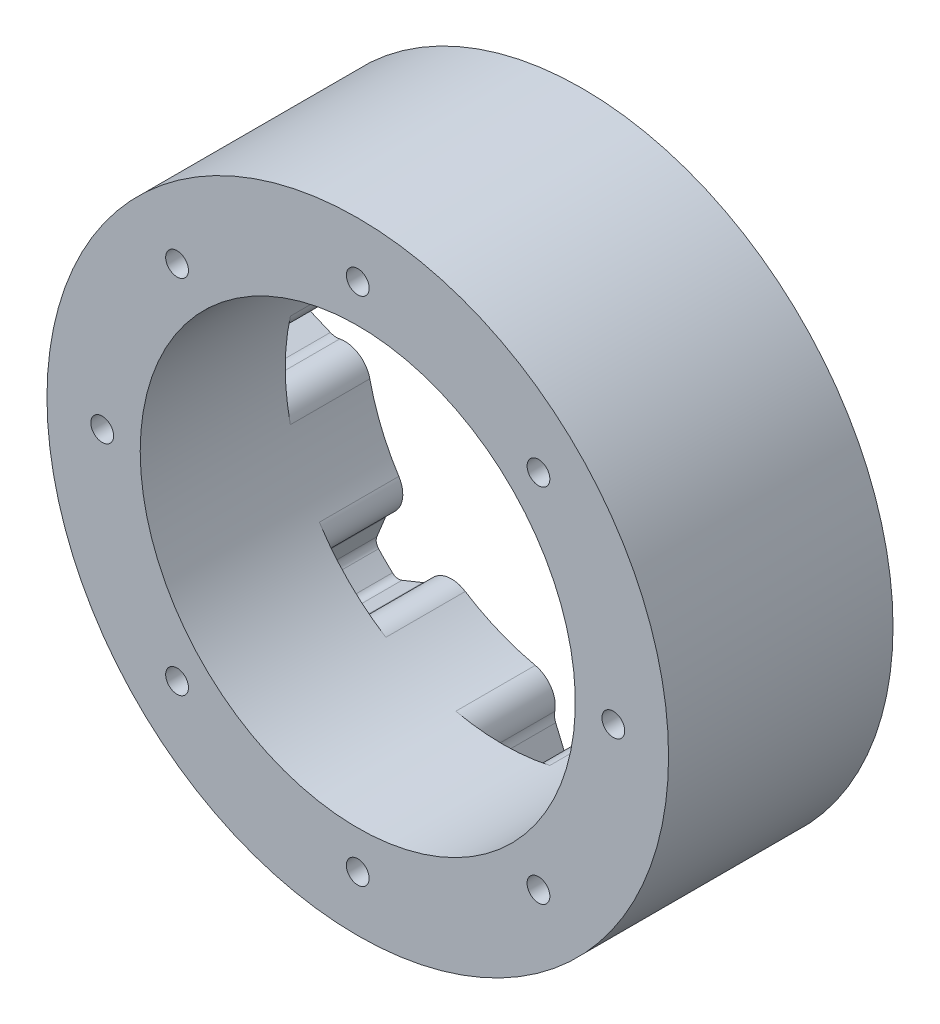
SolidWorks part; units mm, degrees
ref_plane "Front Plane" through (0, 0, 0) normal (1, 0, 0) x (0, 1, 0)
ref_plane "Top Plane" through (0, 0, 0) normal (0, 0, 1) x (0, 1, 0)
ref_plane "Right Plane" through (0, 0, 0) normal (0, 1, 0) x (-1, 0, 0)
sketch "Sketch1" plane through (0, 0, 0) normal (0, 0, 1) x (0, 1, 0)
  circle A0 centre (0, 0) radius 45
  dimension "D1" = 90
extrude "Boss-Extrude1" add sketch "Sketch1" along normal mid plane 32.5
sketch "Sketch2" plane through (0, 0, -16.25) normal (0, 0, -1) x (1, 0, 0)
  line L0 (0, 0) -> (0, 40) construction
  line L1 (-2.2959, 39.365) -> (-3.5687, 36.3529) construction
  line L2 (2.2959, 39.365) -> (3.5687, 36.3529) construction
  line L3 (2.5722, 39.4818) -> (3.8451, 36.4697)
  line L4 (-2.5722, 39.4818) -> (-3.8451, 36.4697)
  circle A0 centre (0, 0) radius 40 construction
  circle A1 centre (0, 0) radius 31.2 construction
  arc A2 (1.41, 39.9751) -> (-1.41, 39.9751) centre (0, 0) ccw construction
  arc A3 (-1.41, 39.9751) -> (-2.2959, 39.365) centre (-1.3747, 38.9758) ccw construction
  arc A4 (-3.5687, 36.3529) -> (-3.6857, 35.1726) centre (-1.7265, 35.5744) ccw construction
  arc A5 (-3.6857, 35.1726) -> (-6.74, 30.4633) centre (-7.6041, 34.3688) cw construction
  arc A6 (3.6857, 35.1726) -> (6.74, 30.4633) centre (7.6041, 34.3688) ccw construction
  arc A7 (3.5687, 36.3529) -> (3.6857, 35.1726) centre (1.7265, 35.5744) cw construction
  arc A8 (1.41, 39.9751) -> (2.2959, 39.365) centre (1.3747, 38.9758) cw construction
  circle A9 centre (0, 0) radius 31.5 construction
  arc A10 (3.9796, 35.1123) -> (6.8048, 30.7562) centre (7.6041, 34.3688) ccw
  arc A11 (3.8451, 36.4697) -> (3.9796, 35.1123) centre (1.7265, 35.5744) cw
  arc A12 (1.4206, 40.275) -> (2.5722, 39.4818) centre (1.3747, 38.9758) cw
  arc A13 (1.4206, 40.275) -> (-1.4206, 40.275) centre (0, 0) ccw
  arc A14 (-1.4206, 40.275) -> (-2.5722, 39.4818) centre (-1.3747, 38.9758) ccw
  arc A15 (-3.8451, 36.4697) -> (-3.9796, 35.1123) centre (-1.7265, 35.5744) ccw
  arc A16 (-3.9796, 35.1123) -> (-6.8048, 30.7562) centre (-7.6041, 34.3688) cw
  arc A17 (-6.8048, 30.7562) -> (6.8048, 30.7562) centre (0, 0) cw
  point P7 (0, 40)
  dimension "D1" = 80
  dimension "D2" = 62.4
  dimension "D3" = 1
  dimension "D4" = 2
  dimension "D6" = 4
  dimension "D9" = 0.3
  dimension "D5" = 3.27
  dimension "D7" = 6.74
  dimension "D8" = 2.82
  dimension "D10" = 0.3
extrude "Cut-Extrude1" cut sketch "Sketch2" against normal blind 11.5
pattern_circular "CirPattern1" count 8 over 360 about axis through (0, 0, 0) along (0, 0, 1) of "Cut-Extrude1"
sketch "Sketch3" plane through (0, 0, -16.25) normal (0, 0, -1) x (1, 0, 0)
  circle A0 centre (0, 0) radius 31.5
  arc A1 (6.8048, 30.7562) -> (-6.8048, 30.7562) centre (0, 0) ccw construction
extrude "Cut-Extrude2" cut sketch "Sketch3" against normal through all
sketch "Sketch4" plane through (0, 0, 16.25) normal (0, 0, 1) x (1, 0, 0)
  circle A0 centre (0, 0) radius 31.15
  dimension "D1" = 62.3
sketch "Sketch5" plane through (0, 0, -4.75) normal (0, 0, -1) x (1, 0, 0)
  line L0 (0, 37) -> (0, 0) construction
  circle A0 centre (0, 37) radius 1.65
  dimension "D1" = 3.3
  dimension "D2" = 37
extrude "Cut-Extrude4" cut sketch "Sketch5" against normal through all
pattern_circular "CirPattern2" count 8 over 360 about axis through (0, 0, 0) along (0, 0, 1) of "Cut-Extrude4"
